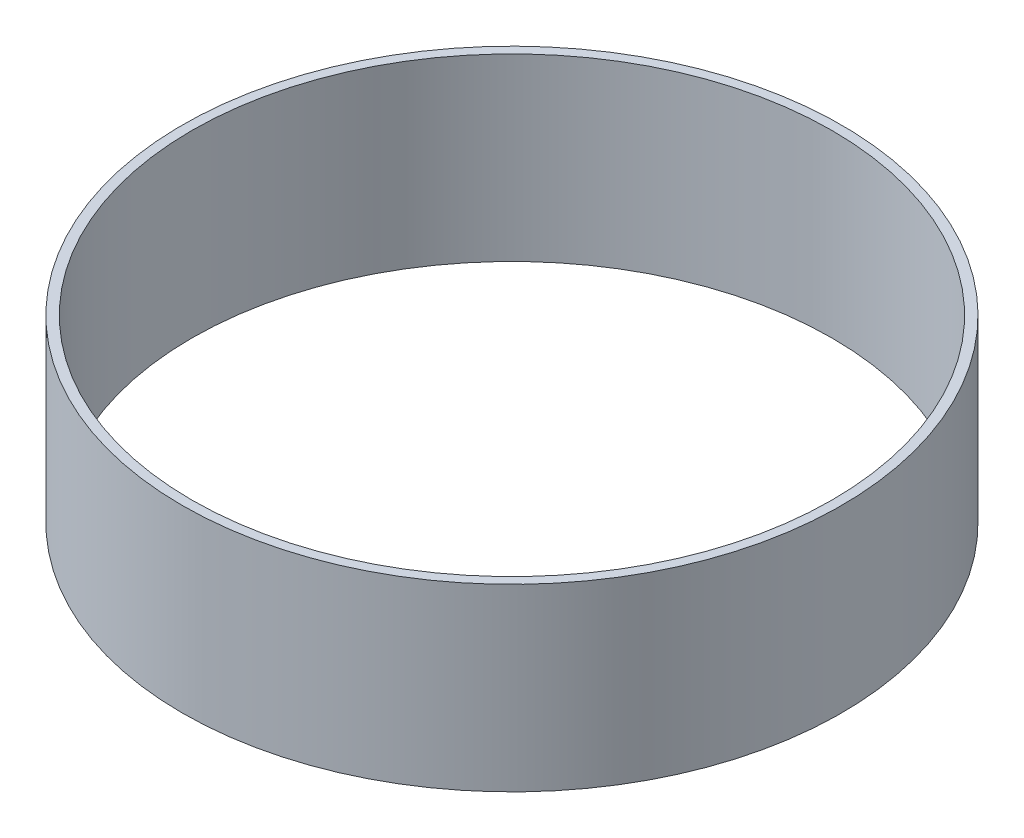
SolidWorks part; units mm, degrees
ref_plane "Front Plane" through (0, 0, 0) normal (0, 0, 1) x (1, 0, 0)
ref_plane "Top Plane" through (0, 0, 0) normal (0, 1, 0) x (1, 0, 0)
ref_plane "Right Plane" through (0, 0, 0) normal (1, 0, 0) x (0, 0, -1)
sketch "Sketch2" plane through (0, 0, 0) normal (0, 1, 0) x (1, 0, 0)
  circle A0 centre (0, 0) radius 33
  circle A1 centre (0, 0) radius 32.05
extrude "Boss-Extrude1" add sketch "Sketch2" along normal blind 18
